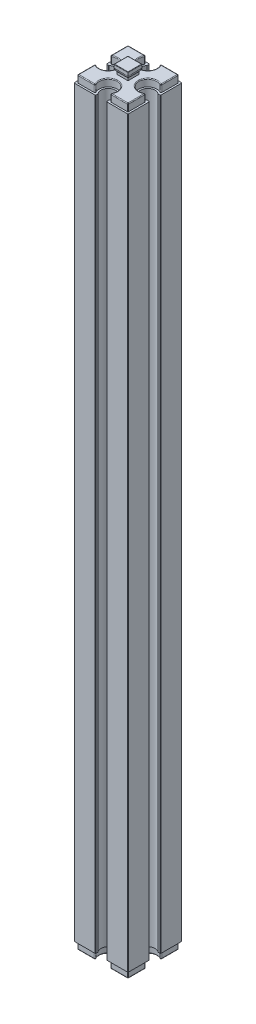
SolidWorks part; units mm, degrees
ref_plane "前视基准面" through (0, 0, 0) normal (0, 0, 1) x (1, 0, 0)
ref_plane "上视基准面" through (0, 0, 0) normal (0, 1, 0) x (1, 0, 0)
ref_plane "右视基准面" through (0, 0, 0) normal (1, 0, 0) x (0, 0, -1)
sketch "草图1" plane through (0, 0, 0) normal (0, 1, 0) x (1, 0, 0)
  line L0 (0, 0) -> (0, 7.5) construction
  line L1 (0, 0) -> (7.5, 0) construction
  line L2 (-7.5, 7.5) -> (-1.5, 7.5)
  line L3 (7.5, 7.5) -> (7.5, 1.5)
  line L4 (6.8229, 1.5) -> (7.5, 1.5)
  line L5 (6.8229, -1.5) -> (7.5, -1.5)
  line L6 (0, 7.5) -> (0, 5.5) construction
  line L7 (-1.5, 6.8229) -> (-1.5, 7.5)
  line L8 (1.5, 6.8229) -> (1.5, 7.5)
  line L9 (1.5, 7.5) -> (7.5, 7.5)
  line L10 (7.5, -1.5) -> (7.5, -7.5)
  line L11 (7.5, -7.5) -> (1.5, -7.5)
  line L12 (1.5, -6.8229) -> (1.5, -7.5)
  line L13 (-1.5, -6.8229) -> (-1.5, -7.5)
  line L14 (-1.5, -7.5) -> (-7.5, -7.5)
  line L15 (-7.5, -7.5) -> (-7.5, -1.5)
  line L16 (-6.8229, -1.5) -> (-7.5, -1.5)
  line L17 (-6.8229, 1.5) -> (-7.5, 1.5)
  line L18 (-7.5, 1.5) -> (-7.5, 7.5)
  arc A0 (-1.5, 6.8229) -> (1.5, 6.8229) centre (0, 5.5) ccw
  arc A1 (6.8229, 1.5) -> (6.8229, -1.5) centre (5.5, 0) ccw
  arc A2 (1.5, -6.8229) -> (-1.5, -6.8229) centre (0, -5.5) ccw
  arc A3 (-6.8229, -1.5) -> (-6.8229, 1.5) centre (-5.5, 0) ccw
  point P36 (0, 0)
  dimension "D6" = 4
  dimension "D7" = 2
  dimension "D1" = 7.5
  dimension "D2" = 7.5
  dimension "D3" = 2
  dimension "D4" = 7.5
  dimension "D5" = 1.5
extrude "凸台-拉伸1" add sketch "草图1" along normal blind 103
sketch "草图2" plane through (0, 103, 0) normal (0, 1, 0) x (1, 0, 0)
  line L0 (-7, 7) -> (-7, 2)
  line L1 (-7, 2) -> (-7, 2)
  line L2 (-7, -2) -> (-7, -2)
  line L3 (-7, -2) -> (-7, -7)
  line L4 (-7, -7) -> (-2, -7)
  line L5 (-2, -7) -> (-2, -7)
  line L6 (2, -7) -> (2, -7)
  line L7 (2, -7) -> (7, -7)
  line L8 (7, -7) -> (7, -2)
  line L9 (7, -2) -> (7, -2)
  line L10 (7, 2) -> (7, 2)
  line L11 (7, 2) -> (7, 7)
  line L12 (7, 7) -> (2, 7)
  line L13 (2, 7) -> (2, 7)
  line L14 (-2, 7) -> (-2, 7)
  line L15 (-2, 7) -> (-7, 7)
  line L16 (-7.5, 7.5) -> (-7.5, 1.5)
  line L17 (-7.5, 1.5) -> (-6.8229, 1.5)
  line L18 (-6.8229, -1.5) -> (-7.5, -1.5)
  line L19 (-7.5, -1.5) -> (-7.5, -7.5)
  line L20 (-7.5, -7.5) -> (-1.5, -7.5)
  line L21 (-1.5, -7.5) -> (-1.5, -6.8229)
  line L22 (1.5, -6.8229) -> (1.5, -7.5)
  line L23 (1.5, -7.5) -> (7.5, -7.5)
  line L24 (7.5, -7.5) -> (7.5, -1.5)
  line L25 (7.5, -1.5) -> (6.8229, -1.5)
  line L26 (6.8229, 1.5) -> (7.5, 1.5)
  line L27 (7.5, 1.5) -> (7.5, 7.5)
  line L28 (7.5, 7.5) -> (1.5, 7.5)
  line L29 (1.5, 7.5) -> (1.5, 6.8229)
  line L30 (-1.5, 6.8229) -> (-1.5, 7.5)
  line L31 (-1.5, 7.5) -> (-7.5, 7.5)
  line L32 (-7.5, 7.5) -> (-7.5, 1.5) construction
  line L33 (-7.5, 1.5) -> (-6.8229, 1.5) construction
  line L34 (-6.8229, -1.5) -> (-7.5, -1.5) construction
  line L35 (-7.5, -1.5) -> (-7.5, -7.5) construction
  line L36 (-7.5, -7.5) -> (-1.5, -7.5) construction
  line L37 (-1.5, -7.5) -> (-1.5, -6.8229) construction
  line L38 (1.5, -6.8229) -> (1.5, -7.5) construction
  line L39 (1.5, -7.5) -> (7.5, -7.5) construction
  line L40 (7.5, -7.5) -> (7.5, -1.5) construction
  line L41 (7.5, -1.5) -> (6.8229, -1.5) construction
  line L42 (6.8229, 1.5) -> (7.5, 1.5) construction
  line L43 (7.5, 1.5) -> (7.5, 7.5) construction
  line L44 (7.5, 7.5) -> (1.5, 7.5) construction
  line L45 (1.5, 7.5) -> (1.5, 6.8229) construction
  line L46 (-1.5, 6.8229) -> (-1.5, 7.5) construction
  line L47 (-1.5, 7.5) -> (-7.5, 7.5) construction
  arc A0 (-7, -2) -> (-7, 2) centre (-5.5, 0) ccw
  arc A1 (2, -7) -> (-2, -7) centre (0, -5.5) ccw
  arc A2 (7, 2) -> (7, -2) centre (5.5, 0) ccw
  arc A3 (-2, 7) -> (2, 7) centre (0, 5.5) ccw
  arc A4 (-6.8229, -1.5) -> (-6.8229, 1.5) centre (-5.5, 0) ccw
  arc A5 (1.5, -6.8229) -> (-1.5, -6.8229) centre (0, -5.5) ccw
  arc A6 (6.8229, 1.5) -> (6.8229, -1.5) centre (5.5, 0) ccw
  arc A7 (-1.5, 6.8229) -> (1.5, 6.8229) centre (0, 5.5) ccw
  arc A8 (-6.8229, -1.5) -> (-6.8229, 1.5) centre (-5.5, 0) ccw construction
  arc A9 (1.5, -6.8229) -> (-1.5, -6.8229) centre (0, -5.5) ccw construction
  arc A10 (6.8229, 1.5) -> (6.8229, -1.5) centre (5.5, 0) ccw construction
  arc A11 (-1.5, 6.8229) -> (1.5, 6.8229) centre (0, 5.5) ccw construction
  dimension "D1" = 0
  dimension "D2" = 0.5
extrude "凸台-拉伸2" add sketch "草图2" along normal blind 2
sketch "草图3" plane through (0, 0, 0) normal (1, 0, 0) x (0, 0, -1)
  line L0 (0, 105) -> (0, 107) construction
  line L1 (2.5, 105) -> (-2.5, 105) construction
  line L2 (0, 107) -> (0, 107.5) construction
  line L3 (-1.5, 105) -> (1.5, 105)
  line L4 (1.5, 105) -> (1.5, 105.6771)
  line L5 (-1.95, 107.5) -> (1.95, 107.5)
  line L6 (1.95, 107.5) -> (1.95, 106.5556)
  line L7 (-1.5, 105) -> (-1.5, 105.6771)
  line L8 (-1.95, 107.5) -> (-1.95, 106.5556)
  arc A0 (-1.5, 105.6771) -> (-1.95, 106.5556) centre (0, 107) cw
  arc A1 (1.5, 105.6771) -> (1.95, 106.5556) centre (0, 107) ccw
  dimension "D5" = 2
  dimension "D1" = 2
  dimension "D2" = 0.5
  dimension "D3" = 1.5
  dimension "D4" = 1.95
extrude "凸台-拉伸3" add sketch "草图3" along normal blind 2 and the other way blind 2
sketch "草图4" plane through (0, 0, 0) normal (0, 0, 1) x (1, 0, 0)
  line L0 (0, 105) -> (0, 107) construction
  line L2 (-2, 105) -> (2, 105) construction
  line L3 (0, 107) -> (0, 107.5) construction
  line L4 (-2, 107.5) -> (2, 107.5) construction
  line L5 (1.95, 107.5) -> (2, 107.5)
  line L6 (-1.95, 107.5) -> (-1.95, 106.5556)
  line L9 (-1.5, 105) -> (-1.5, 105.6771)
  line L10 (1.5, 105) -> (1.5, 105.6771)
  line L11 (1.95, 107.5) -> (1.95, 106.5556)
  line L12 (1.5, 105) -> (2, 105)
  line L13 (-2, 107.5) -> (-1.95, 107.5)
  line L14 (-2, 107.5) -> (-2, 105)
  line L15 (-2, 105) -> (-1.5, 105)
  line L16 (2, 107.5) -> (2, 105)
  arc A0 (-1.95, 106.5556) -> (-1.5, 105.6771) centre (0, 107) ccw
  arc A1 (1.95, 106.5556) -> (1.5, 105.6771) centre (0, 107) cw
  dimension "D1" = 2
  dimension "D2" = 1.5
  dimension "D3" = 1.95
fillet "圆角3" radius 0.2 13 edges at (-1.5, 51.5, -7.5) (1.5, 51.5, -7.5) (7.5, 51.5, -7.5) (7.5, 51.5, -1.5) (7.5, 51.5, 1.5) (7.5, 51.5, 7.5) (-1.5, 51.5, 7.5) (1.5, 51.5, 7.5) (-6.8229, 51.5, -1.5) (-7.5, 51.5, 7.5) (-7.5, 51.5, 1.5) (-7.5, 51.5, -1.5) (-7.5, 51.5, -7.5)
extrude "切除-拉伸1" cut sketch "草图4" against normal blind 3 and the other way blind 3
fillet "圆角4" radius 0.2 24 edges at (0, 105, 3) (-3, 105, 0) (0, 105, -3) (3, 105, 0) (7, 104, 2) (7, 104, -2) (2, 104, -7) (-2, 104, -7) (-7, 104, 2) (-7, 104, -2) (2, 104, 7) (-2, 104, 7) (7, 104, 7) (4.5, 105, 7) (7, 105, 4.5) (7, 105, -4.5) (7, 104, -7) (4.5, 105, -7) (-4.5, 105, -7) (-7, 104, -7) (-7, 105, -4.5) (-4.5, 105, 7) (-7, 105, 4.5) (-7, 104, 7)
fillet "圆角5" radius 0.1 4 edges at (0, 107.5, -1.95) (1.95, 107.5, 0) (0, 107.5, 1.95) (-1.95, 107.5, 0)
mirror "镜向1" of "圆角5", "圆角4", "切除-拉伸1", "圆角3", "凸台-拉伸3", "凸台-拉伸2", "凸台-拉伸1"
